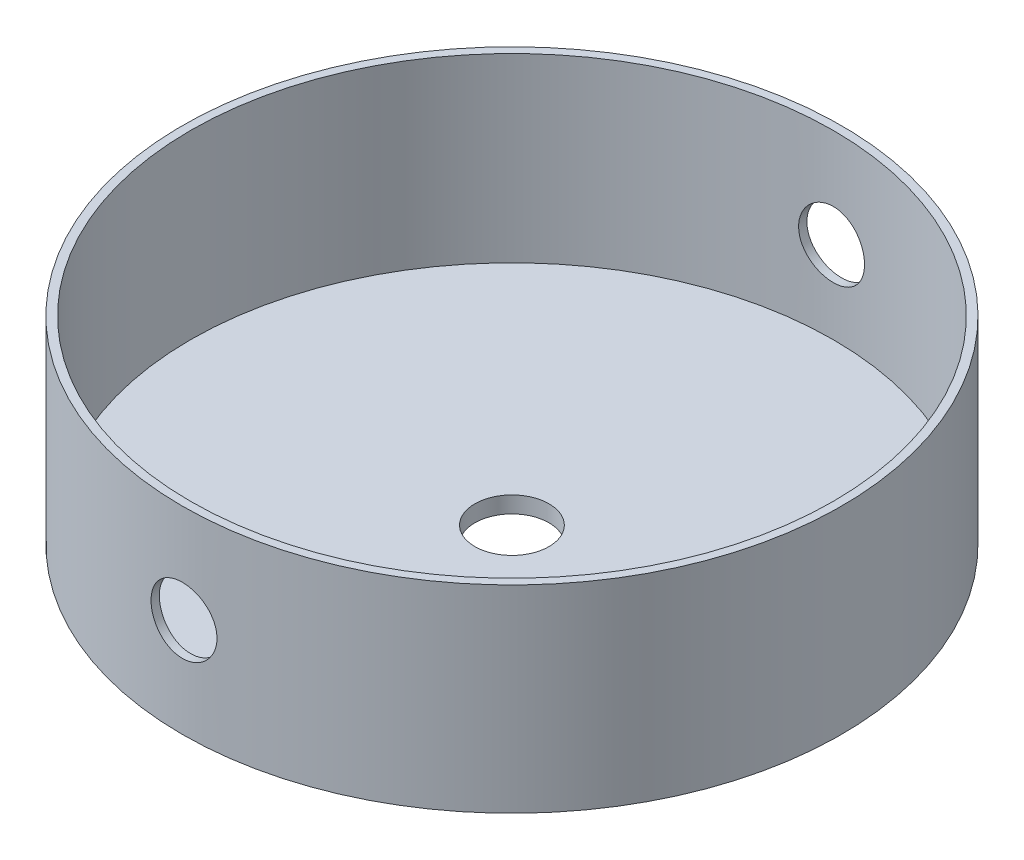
SolidWorks part; units mm, degrees
ref_plane "Alzado" through (0, 0, 0) normal (0, 0, 1) x (1, 0, 0)
ref_plane "Planta" through (0, 0, 0) normal (0, 1, 0) x (1, 0, 0)
ref_plane "Vista lateral" through (0, 0, 0) normal (1, 0, 0) x (0, 0, -1)
sketch "Croquis1" plane through (0, 0, 0) normal (0, 1, 0) x (1, 0, 0)
  circle A0 centre (0, 0) radius 40
  dimension "D1" = 80
extrude "Saliente-Extruir1" add sketch "Croquis1" along normal blind 2
sketch "Croquis2" plane through (0, 2, 0) normal (0, 1, 0) x (1, 0, 0)
  circle A0 centre (0, 0) radius 39
  circle A1 centre (0, 0) radius 40
  circle A2 centre (0, 0) radius 40
  dimension "D1" = 0
  dimension "D2" = 1
extrude "Saliente-Extruir2" add sketch "Croquis2" along normal blind 22
sketch "Croquis3" plane through (0, 0, 0) normal (0, 0, 1) x (1, 0, 0)
  line L0 (0, 24) -> (0, 12) construction
  line L1 (40, 24) -> (-40, 24) construction
  circle A0 centre (0, 12) radius 4
  dimension "D2" = 8
  dimension "D1" = 12
extrude "Cortar-Extruir1" cut sketch "Croquis3" against normal through all both and the other way through all
sketch "Croquis4" plane through (0, 2, 0) normal (0, 1, 0) x (1, 0, 0)
  circle A0 centre (0, 0) radius 4.5
  dimension "D1" = 9
extrude "Cortar-Extruir2" cut sketch "Croquis4" against normal blind 22
